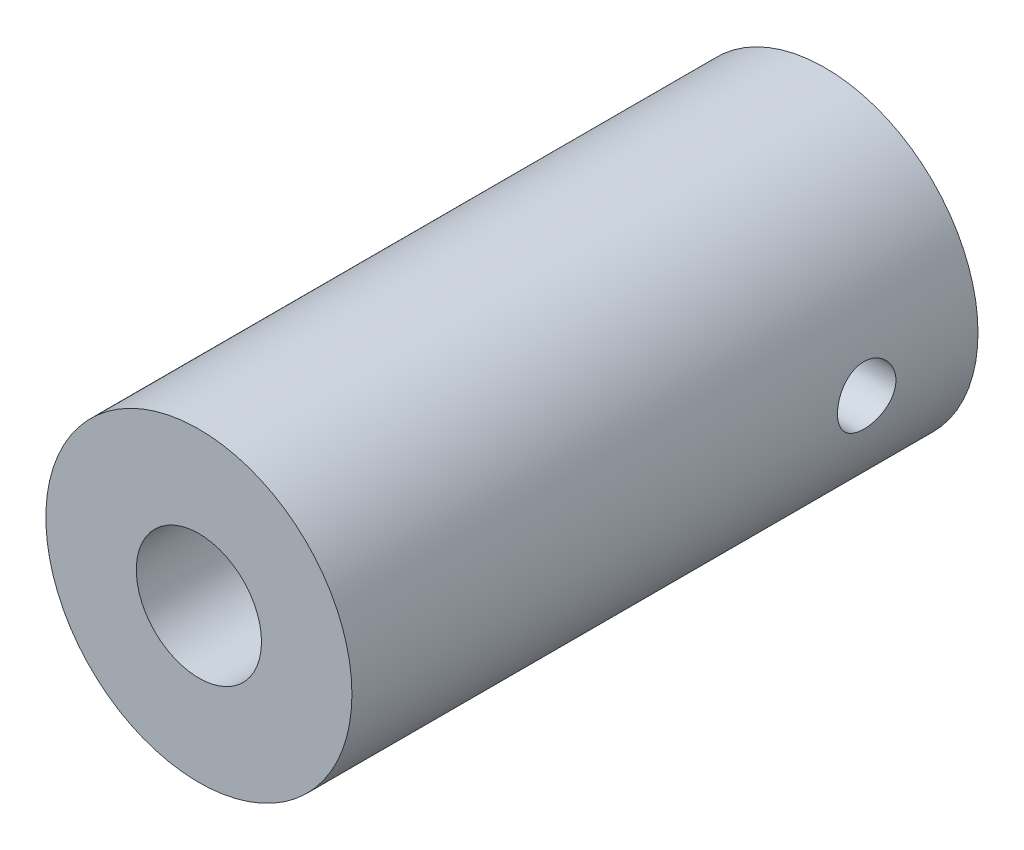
SolidWorks part; units mm, degrees
ref_plane "Front Plane" through (0, 0, 0) normal (0, 0, 1) x (1, 0, 0)
ref_plane "Top Plane" through (0, 0, 0) normal (0, 1, 0) x (1, 0, 0)
ref_plane "Right Plane" through (0, 0, 0) normal (1, 0, 0) x (0, 0, -1)
sketch "Sketch1" plane through (0, 0, 0) normal (0, 0, 1) x (1, 0, 0)
  circle A0 centre (0, 0) radius 4.5
  circle A1 centre (0, 0) radius 11
  dimension "D1" = 9
  dimension "D2" = 22
extrude "Boss-Extrude1" add sketch "Sketch1" along normal blind 45
ref_plane "Plane1" through (11, 0, 0) normal (1, 0, 0) x (0, 0, -1)
sketch "Sketch3" plane through (11, 0, 0) normal (1, 0, 0) x (0, 0, -1)
  point P0 (-8, 0)
  point P1 (-8, 0)
  dimension "D1" = 8
hole_wizard "M5 Tapped Hole1" positions "Sketch5" profile "Sketch7" tap size "M5" standard "DIN"
sketch "Sketch5" plane through (11, 0, 0) normal (1, 0, 0) x (0, 0, -1)
  point P0 (-8, 0)
sketch "Sketch7" plane through (11, 0, 8) normal (0, 1, 0) x (0, 0, -1)
  line L0 (0, 0) -> (0, 6.5)
  line L1 (0, 6.5) -> (2.1, 6.5)
  line L2 (2.1, 6.5) -> (2.1, 0)
  line L5 (2.1, 0) -> (0, 0)
  line L11 (0, -6.35) -> (0, 107.95) construction
  dimension "Thru Tap Drill Dia." = 4.2
  dimension "Thru Tap Drill Depth" = 6.5
